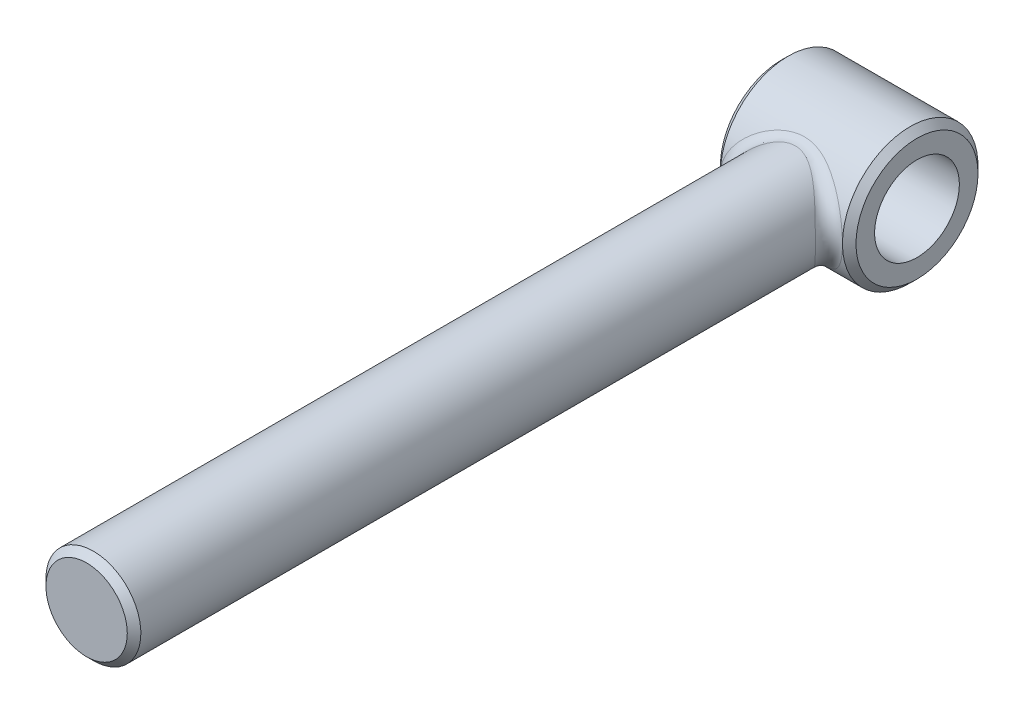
SolidWorks part; units mm, degrees
ref_plane "Ebene vorne" through (0, 0, 0) normal (0, 0, 1) x (1, 0, 0)
ref_plane "Ebene oben" through (0, 0, 0) normal (0, 1, 0) x (1, 0, 0)
ref_plane "Ebene rechts" through (0, 0, 0) normal (1, 0, 0) x (0, 0, -1)
sketch "Skizze1" plane through (0, 0, 0) normal (1, 0, 0) x (0, 0, -1)
  circle A1 centre (0, 0) radius 40
  dimension "D1" = 80
extrude "Aufsatz-Linear austragen1" add sketch "Skizze1" along normal mid plane 80
sketch "Skizze2" plane through (0, 0, 0) normal (0, 0, 1) x (1, 0, 0)
  circle A0 centre (0, 0) radius 28
  dimension "D1" = 56
extrude "Aufsatz-Linear austragen2" add sketch "Skizze2" along normal blind 450
sketch "Skizze3" plane through (0, 0, 0) normal (1, 0, 0) x (0, 0, -1)
  circle A0 centre (0, 0) radius 25
  dimension "D1" = 50
extrude "Schnitt-Linear austragen1" cut sketch "Skizze3" against normal through all both and the other way through all
fillet "Verrundung1" radius 8 1 edges at (-27.6862, -4.18, 39.781)
chamfer "Fase1" distance 4 angle 45 2 edges at (-40, 0, -40) (40, 0, -40)
chamfer "Fase2" distance 4 angle 45 1 edges at (28, 0, 450)
